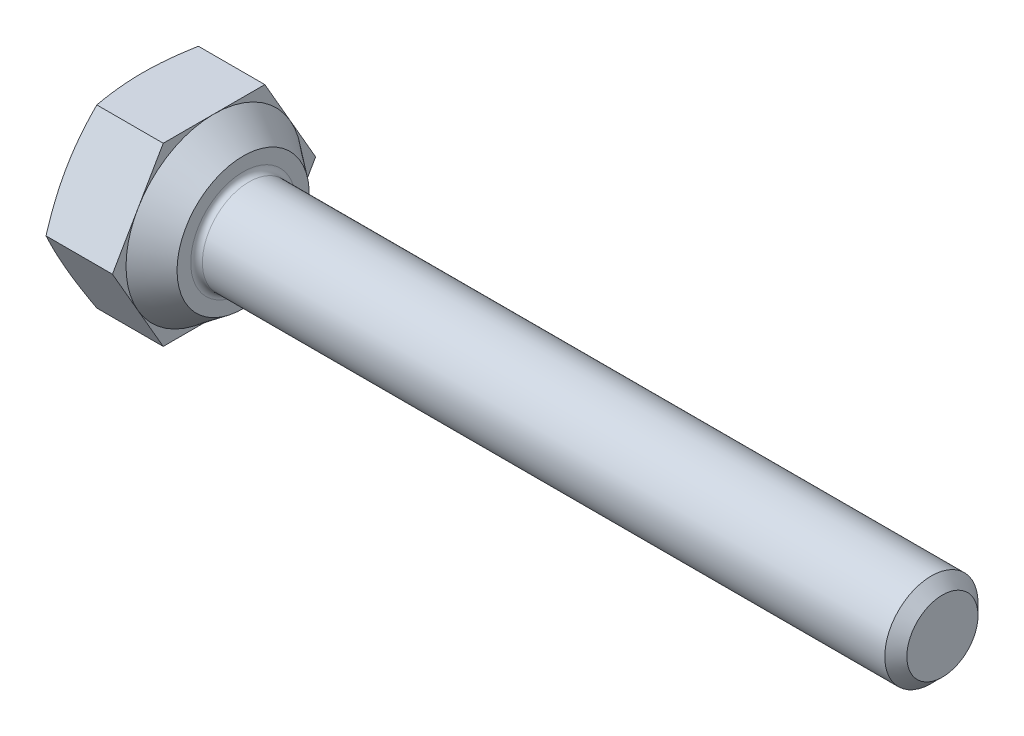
SolidWorks part; units mm, degrees
ref_plane "Front" through (0, 0, 0) normal (0, 0, 1) x (1, 0, 0)
ref_plane "Top" through (0, 0, 0) normal (0, 1, 0) x (1, 0, 0)
ref_plane "Right" through (0, 0, 0) normal (1, 0, 0) x (0, 0, -1)
sketch "Sketch-BaseHead" plane through (0, 0, 0) normal (1, 0, 0) x (0, 0, -1)
  line L1 (1.7436, 0) -> (0.8718, 1.51)
  line L2 (0.8718, 1.51) -> (-0.8718, 1.51)
  line L3 (-0.8718, 1.51) -> (-1.7436, 0)
  line L4 (-1.7436, 0) -> (-0.8718, -1.51)
  line L5 (-0.8718, -1.51) -> (0.8718, -1.51)
  line L6 (0.8718, -1.51) -> (1.7436, 0)
  circle A0 centre (0, 0) radius 1.51 construction
  dimension "s" = 3.02
extrude "BaseHead" add sketch "Sketch-BaseHead" along normal blind 1.225
sketch "Sketch4" plane through (-0.2646, 0, 5.9169) normal (0, 1, 0) x (0, 0, -1)
  line L0 (5.9169, 3.7369) -> (5.9169, -10.4477) construction
  line L2 (7.6605, -0.2646) -> (7.4269, -0.2646)
  line L4 (7.4269, -0.2646) -> (7.6605, -0.3497)
  line L6 (7.6605, -0.3497) -> (7.6605, -0.2646)
  dimension "D1" = 20
  dimension "D2" = 3.02
revolve "HeadChamfer" cut sketch "Sketch4" angle 360 about L0
sketch "Sketch1" plane through (0, 0, 0) normal (0, 0, 1) x (1, 0, 0)
  line L0 (1.225, 0) -> (1.725, 0)
  line L1 (1.725, 0) -> (1.725, -1.135)
  line L2 (1.725, -1.135) -> (1.225, -1.51)
  line L3 (1.225, -1.51) -> (1.225, 0) construction
  line L4 (0, 0) -> (7.5821, 0) construction
  line L5 (-4.0016, 0) -> (10.1831, 0) construction
  line L6 (1.225, -1.51) -> (0.085, -1.51) construction
  line L7 (1.225, 0) -> (1.225, -1.51)
  dimension "D1" = 1.51
  dimension "c" = 0.5
  dimension "D2" = 1.135
revolve "Revolve1" add sketch "Sketch1" angle 360 about axis through (-4.0016, 0, 0) along (1, 0, 0)
ref_plane "Plane2" through (4.725, 0, 0) normal (1, 0, 0) x (0, 0, -1)
sketch "Sketch3" plane through (1.725, 0, 0) normal (1, 0, 0) x (0, 0, -1)
  circle A0 centre (0, 0) radius 0.8
  dimension "d" = 1.6
extrude "BaseBody" add sketch "Sketch3" along normal blind 12
fillet "HeadFillet" radius 0.1 1 edges at (1.725, 0, -0.8)
chamfer "Chamfer1" distance 0.1895 angle 45 1 edges at (13.725, 0, -0.8)
equation "\"D1@Sketch1\" = \"s@Sketch-BaseHead\"/ 2"
equation "\"D2@Sketch4\" = \"s@Sketch-BaseHead\""
equation "\"D1@Chamfer1\" =  ( \"d@Sketch3\" - \"D2@ThreadCosmetic1\" ) / 2 "
equation "\"b@ThreadCosmetic1\" = \"l@BaseBody\" - \"lg@Plane2\""
